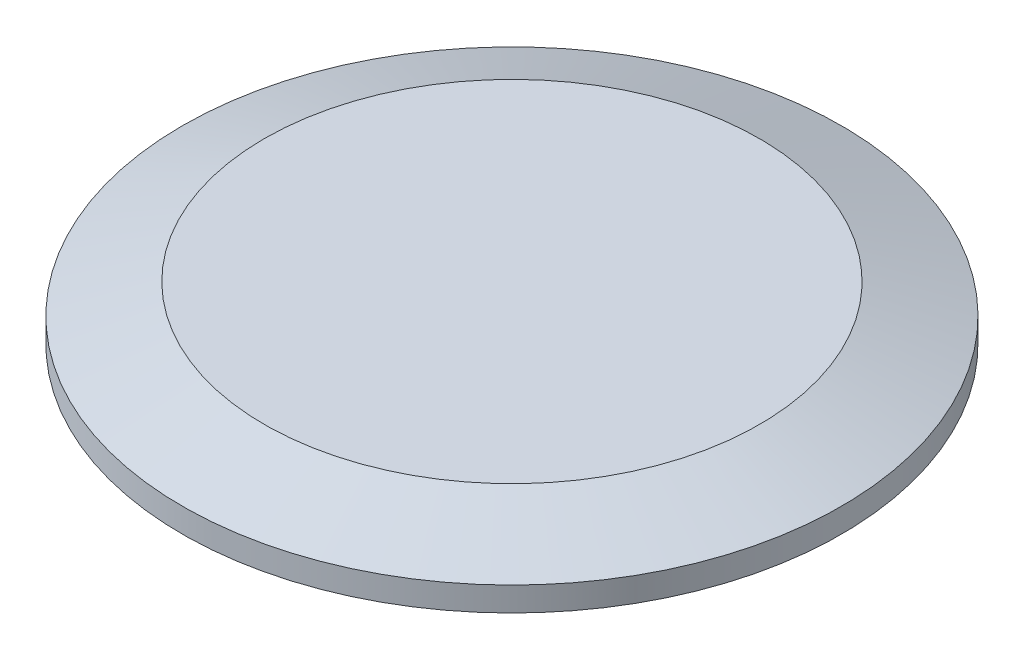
SolidWorks part; units mm, degrees
ref_plane "Front Plane" through (0, 0, 0) normal (0, 0, 1) x (1, 0, 0)
ref_plane "Top Plane" through (0, 0, 0) normal (0, 1, 0) x (1, 0, 0)
ref_plane "Right Plane" through (0, 0, 0) normal (1, 0, 0) x (0, 0, -1)
sketch "Sketch1" plane through (0, 0, 0) normal (0, 0, 1) x (1, 0, 0)
  line L0 (0, 0) -> (-33.5007, 0)
  line L1 (-38.7223, 0) -> (-38.7223, 2.8448)
  line L2 (-38.7223, 2.8448) -> (-29.0918, 6.35)
  line L3 (-29.0918, 6.35) -> (0, 6.35)
  line L4 (0, 6.35) -> (0, 0) construction
  line L5 (-37.1367, 0) -> (-38.7223, 0)
  line L6 (0, 0) -> (0, 6.35)
  arc A0 (-34.2232, 0.4745) -> (-36.4142, 0.4745) centre (-35.3187, 0) ccw
  arc A1 (-33.5007, 0) -> (-34.2232, 0.4745) centre (-33.5007, 0.7874) cw
  arc A2 (-37.1367, 0) -> (-36.4142, 0.4745) centre (-37.1367, 0.7874) ccw
  point P13 (-36.5125, 0)
  dimension "D1" = 2.3876
  dimension "D2" = 0.7874
  dimension "D3" = 38.7223
  dimension "D4" = 35.3187
  dimension "D5" = 2.8448
  dimension "D6" = 20
  dimension "D7" = 6.35
revolve "Revolve1" add sketch "Sketch1" angle 360 about L4
